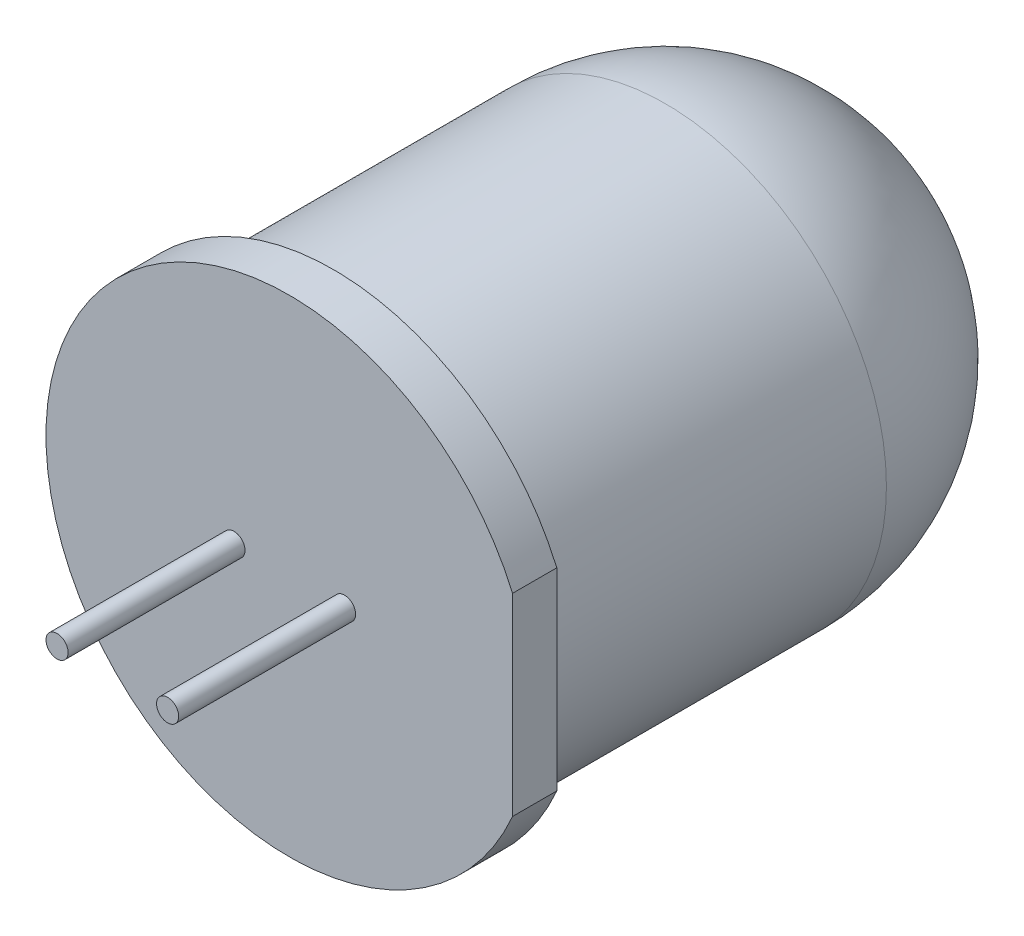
SolidWorks part; units mm, degrees
ref_plane "Face" through (0, 0, 0) normal (0, 0, 1) x (1, 0, 0)
ref_plane "Dessus" through (0, 0, 0) normal (0, 1, 0) x (1, 0, 0)
ref_plane "Droite" through (0, 0, 0) normal (1, 0, 0) x (0, 0, -1)
sketch "Esquisse1" plane through (0, 0, 0) normal (0, 0, 1) x (1, 0, 0)
  circle A0 centre (0, 0) radius 5
extrude "Base-Extrusion" add sketch "Esquisse1" along normal blind 13.5
sketch "Esquisse2" plane through (0, 0, 13.5) normal (0, 0, 1) x (1, 0, 0)
  line L0 (5.0476, -2.4917) -> (5.0476, 2.5621) construction
  line L1 (5.0476, 2.1843) -> (5.0476, -2.1843)
  arc A0 (5.0476, 2.1843) -> (5.0476, -2.1843) centre (0, 0) ccw
extrude "Boss.-Extru.1" add sketch "Esquisse2" against normal blind 1
fillet "Congé1" radius 5 1 edges at (5, 0, 0)
sketch "Esquisse3" plane through (0, 0, 13.5) normal (0, 0, 1) x (1, 0, 0)
  line L0 (6.6041, 0) -> (-9.0558, 0) construction
  line L1 (0, -6.5869) -> (0, 7.9113) construction
  line L2 (-1.27, 2.2189) -> (-1.27, -1.5916) construction
  circle A0 centre (-1.25, 0) radius 0.25
  dimension "D1" = 1.27
ref_plane "Plan1" through (-1.25, 0, 0) normal (1, 0, 0) x (0, 0, -1)
sketch "Esquisse4" plane through (-1.25, 0, 0) normal (1, 0, 0) x (0, 0, -1)
  line L0 (-13.5, 0) -> (-33.943, 0) construction
  line L2 (-13.5, 6.7858) -> (-13.5, -8.0266) construction
  line L3 (-19.5, 5.6624) -> (-19.5, -6.9656) construction
  line L4 (-13.5, -6.5869) -> (-13.5, 7.9113) construction
  line L6 (-13.5, 0) -> (-17.5, 0)
  dimension "D1" = 6
sweep "Balayage1" add profiles "Esquisse3" path "Esquisse4"
ref_plane "Plan2" through (0, 0, 0) normal (1, 0, 0) x (0, 0, -1)
mirror "Symétrie1" about plane through (0, 0, 0) normal (1, 0, 0) of "Balayage1"
